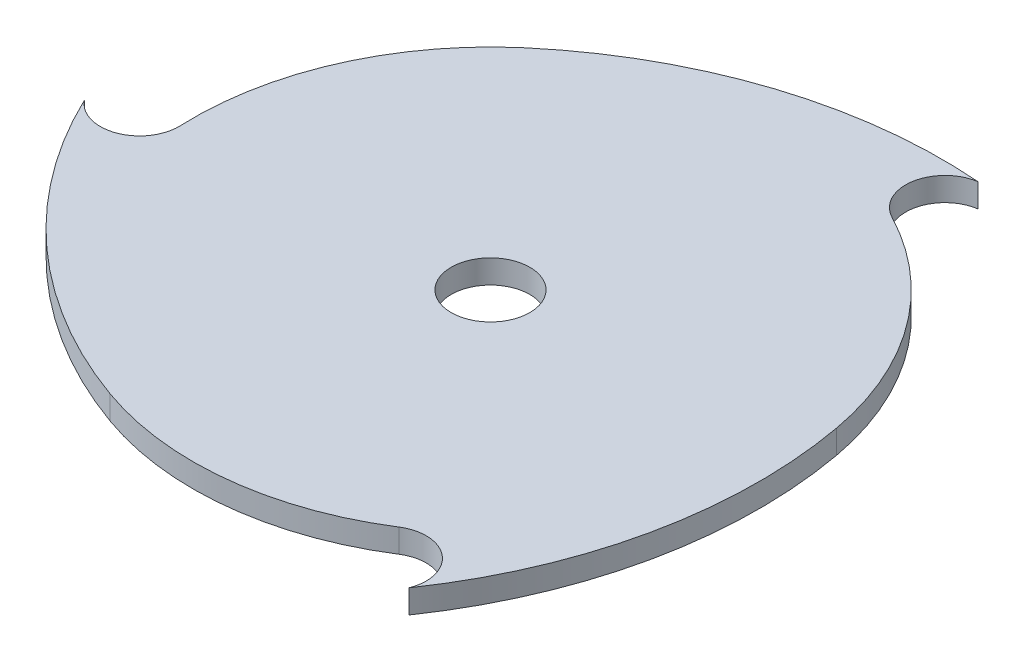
SolidWorks part; units mm, degrees
ref_plane "Front" through (0, 0, 0) normal (0, 0, 1) x (1, 0, 0)
ref_plane "Top" through (0, 0, 0) normal (0, 1, 0) x (1, 0, 0)
ref_plane "Right" through (0, 0, 0) normal (1, 0, 0) x (0, 0, -1)
sketch "Sketch1" plane through (0, 0, 0) normal (0, 1, 0) x (1, 0, 0)
  line L0 (0, 70.3528) -> (0, -78.537) construction
  line L1 (-119.1433, 0) -> (-42.68, 0) construction
  line L2 (22.6694, 53.1001) -> (22.6694, 15.5095) construction
  line L4 (-78.3417, 42.6798) -> (74.2356, 42.6798) construction
  line L5 (22.67, -11.9626) -> (22.67, -57.7519) construction
  line L6 (-32.69, 0) -> (114.7364, 0) construction
  circle A2 centre (0, 0) radius 5
  arc A3 (-24.4975, 28.8447) -> (21.5336, 42.6798) centre (14.3425, -16.8877) cw
  arc A4 (21.5336, 42.6798) -> (17.512, 33.5481) centre (19.8257, 37.9805) ccw
  arc A5 (17.512, 33.5481) -> (37.8437, 0) centre (0, 0) cw
  arc A12 (37.229, 6.7931) -> (22.6694, 30.3026) centre (0, 0) ccw
  arc A15 (26.195, -39.9886) -> (20.2975, -31.9399) centre (22.9792, -36.1599) ccw
  arc A16 (-12.7315, -35.6378) -> (-47.7286, -2.6912) centre (7.4539, 20.8648) cw
  arc A17 (-47.7286, -2.6912) -> (-37.8095, -1.6082) centre (-42.805, -1.8207) ccw
  arc A18 (37.229, 6.7931) -> (26.195, -39.9886) centre (-21.7964, -3.9771) cw
  arc A19 (36.1045, 11.7546) -> (37.8696, 2.345) centre (-21.7964, -3.9771) cw
  arc A20 (-12.7315, -35.6378) -> (20.2975, -31.9399) centre (0, 0) ccw
  arc A21 (-24.4975, 28.8447) -> (-37.8095, -1.6082) centre (0, 0) ccw
  point P25 (20.4468, 30.1705)
  point P35 (0, 0)
  dimension "D2" = 22.6694
  dimension "D3" = 10
  dimension "D4" = 60
  dimension "D5" = 5
  dimension "D15" = 22.67
  dimension "D6" = 3
  dimension "D8" = 42.6798
extrude "Boss-Extrude1" add sketch "Sketch1" along normal blind 3
